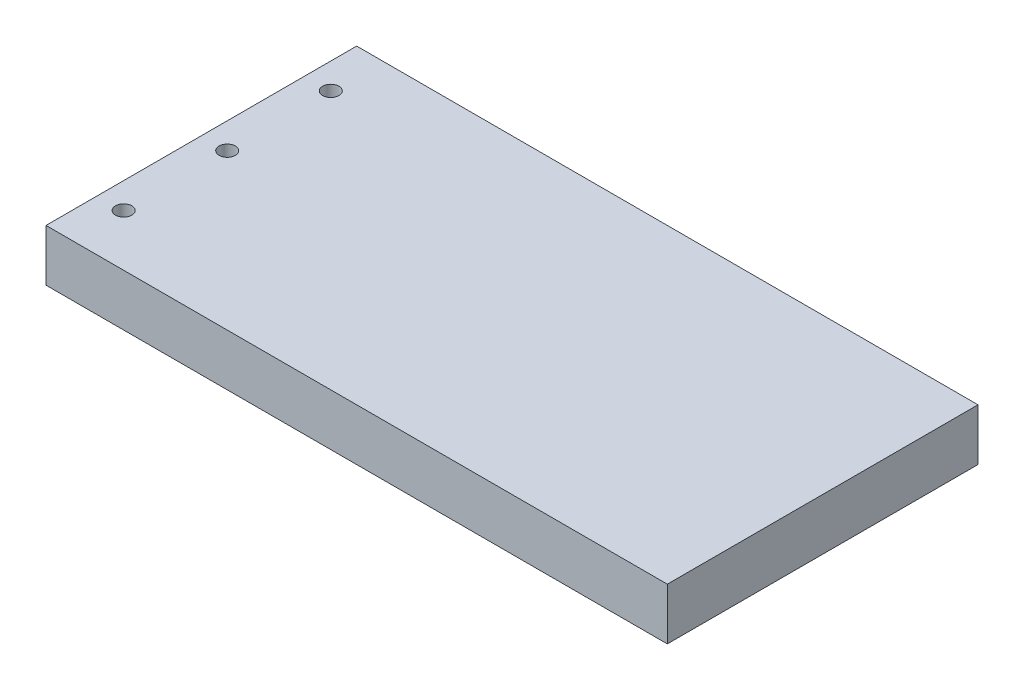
SolidWorks part; units mm, degrees
ref_plane "Front Plane" through (0, 0, 0) normal (0, 0, 1) x (1, 0, 0)
ref_plane "Top Plane" through (0, 0, 0) normal (0, 1, 0) x (1, 0, 0)
ref_plane "Right Plane" through (0, 0, 0) normal (1, 0, 0) x (0, 0, -1)
sketch "Sketch1" plane through (0, 0, 0) normal (0, 1, 0) x (1, 0, 0)
  line L1 (-73.1555, 31.2558) -> (79.2445, 31.2558)
  line L2 (-73.1555, 31.2558) -> (-73.1555, -44.9442)
  line L3 (-73.1555, -44.9442) -> (79.2445, -44.9442)
  line L4 (79.2445, 31.2558) -> (79.2445, -44.9442)
  dimension "D1" = 152.4
  dimension "D2" = 76.2
extrude "Boss-Extrude2" add sketch "Sketch1" along normal blind 12.7
sketch "Sketch2" plane through (0, 12.7, 0) normal (0, 1, 0) x (1, 0, 0)
  line L0 (79.2445, 31.2558) -> (-73.1555, 31.2558) construction
  line L1 (-73.1555, 31.2558) -> (-73.1555, -44.9442) construction
  line L2 (-73.1555, -44.9442) -> (79.2445, -44.9442) construction
  circle A0 centre (-66.8055, 18.5558) radius 2
  circle A1 centre (-66.8055, -6.8442) radius 2
  circle A2 centre (-66.8055, -32.2442) radius 2
  dimension "D7" = 4
  dimension "D8" = 4
  dimension "D9" = 4
  dimension "D1" = 12.7
  dimension "D2" = 6.35
  dimension "D3" = 38.1
  dimension "D4" = 12.7
  dimension "D5" = 6.35
  dimension "D6" = 6.35
extrude "Cut-Extrude1" cut sketch "Sketch2" against normal through all
